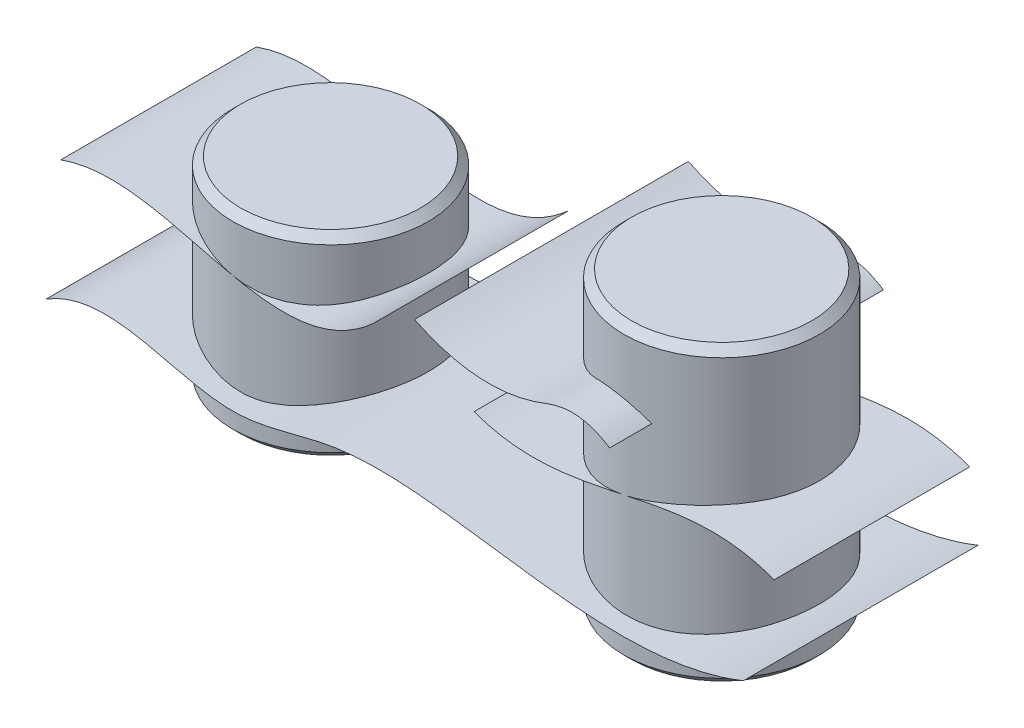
SolidWorks part; units mm, degrees
ref_plane "Front Plane" through (0, 0, 0) normal (0, 0, 1) x (1, 0, 0)
ref_plane "Top Plane" through (0, 0, 0) normal (0, 1, 0) x (1, 0, 0)
ref_plane "Right Plane" through (0, 0, 0) normal (1, 0, 0) x (0, 0, -1)
sketch "Sketch1" plane through (0, 0, 0) normal (0, 1, 0) x (1, 0, 0)
  circle A0 centre (0, 0) radius 25
  dimension "D1" = 50
extrude "Boss-Extrude1" add sketch "Sketch1" along normal blind 50
sketch "Sketch2" plane through (0, 0, 0) normal (0, 1, 0) x (1, 0, 0)
  line L0 (0, 0) -> (100, 0) construction
  circle A0 centre (100, 0) radius 25
  circle A1 centre (0, 0) radius 25 construction
  dimension "D1" = 100
extrude "Boss-Extrude2" add sketch "Sketch2" along normal blind 75 separate body
chamfer "Chamfer1" distance 2 angle 45 2 edges at (0, 0, 25) (0, 50, 25)
chamfer "Chamfer2" distance 2 angle 45 2 edges at (100, 0, 25) (100, 75, 25)
sketch "Sketch3" plane through (0, 0, 0) normal (0, 0, 1) x (1, 0, 0)
  spline S0 degree 3 poles (-44.0005, 39.6611) (-16.5389, 49.6485) (10.8214, 20.5888) (35.9779, 43.4551) knots 0 0 0 0 1 1 1 1
surface "Surface-Extrude1" sketch "Sketch3" parameters "D1"=50
sketch "Sketch4" plane through (0, 0, 0) normal (0, 0, 1) x (1, 0, 0)
  spline S0 degree 2 poles (56.455, 59.5527) (73.5418, 51.1812) (98.679, 61.1451) (106.3359, 56.0258) knots 0 0 0 0.663201 1 1 1
surface "Surface-Extrude2" sketch "Sketch4" parameters "D1"=70
sketch "Sketch5" plane through (0, 0, 0) normal (0, 0, 1) x (1, 0, 0)
  spline S0 degree 3 poles (-42.7704, 11.9284) (-26.5525, 22.1397) (-2.3428, 5.013) (31.3648, 18.1426) (75.3815, 14.8601) (110.6261, 6.6191) (135.5397, 16.5891) knots 0 0 0 0 0.272917 0.405708 0.576864 1 1 1 1
surface "Surface-Extrude3" sketch "Sketch5" parameters "D1"=60
sketch "Sketch6" plane through (0, 0, 0) normal (0, 0, 1) x (1, 0, 0)
  spline S0 degree 3 poles (61.6966, 36.758) (87.2885, 27.2617) (112.376, 47.754) (138.4184, 37.8768) knots 0 0 0 0 1 1 1 1
surface "Surface-Extrude4" sketch "Sketch6" parameters "D1"=50
